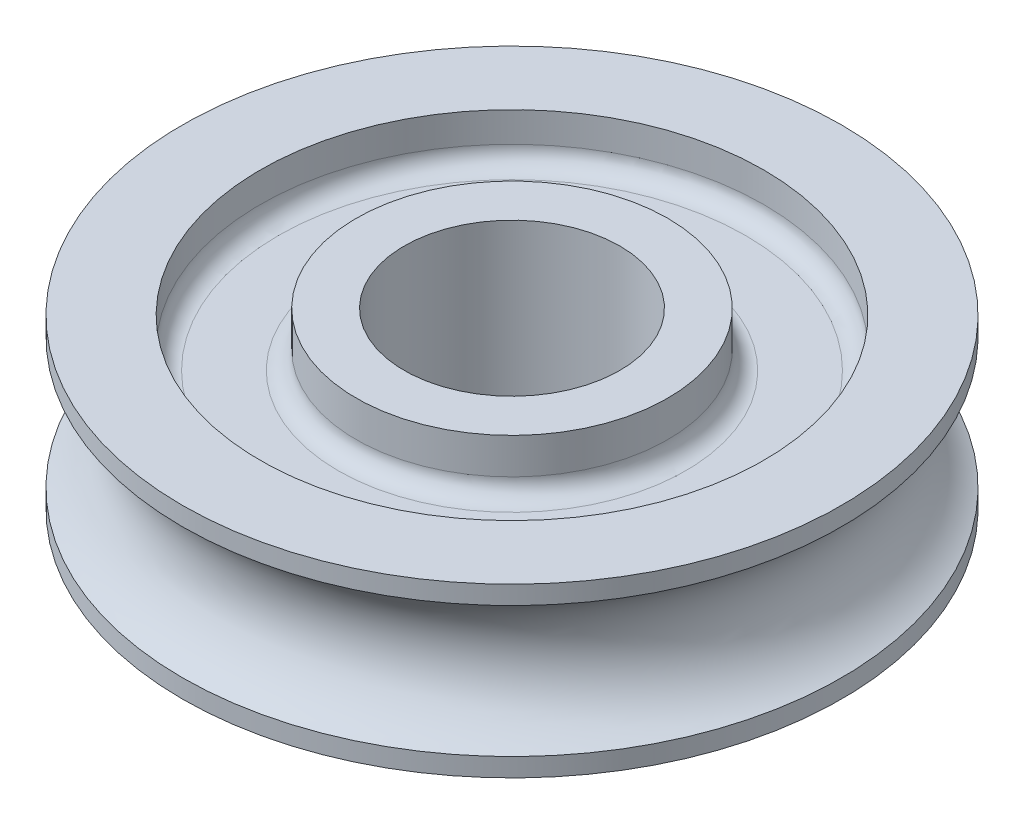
SolidWorks part; units mm, degrees
ref_plane "Plan de face" through (0, 0, 0) normal (0, 0, 1) x (1, 0, 0)
ref_plane "Plan de dessus" through (0, 0, 0) normal (0, 1, 0) x (1, 0, 0)
ref_plane "Plan de droite" through (0, 0, 0) normal (1, 0, 0) x (0, 0, -1)
ref_plane "Plan4" through (0, 0, 0) normal (0, 0, -1) x (-1, 0, 0)
sketch "Esquisse10" plane through (0, 0, 0) normal (0, 0, 1) x (1, 0, 0)
  line L0 (-18, -15) -> (-26, -15)
  line L1 (0, -31.9033) -> (0, 31.9033) construction
  line L3 (-26, -15) -> (-26, -9)
  line L6 (-29, -6) -> (-39, -6)
  line L9 (-42, -9) -> (-42, -14)
  line L11 (-42, -14) -> (-55, -14)
  line L13 (-55, -14) -> (-55, -10.9087)
  line L15 (-55, 14) -> (-55, 10.9087)
  line L18 (-42, 14) -> (-55, 14)
  line L20 (-42, 9) -> (-42, 14)
  line L23 (-29, 6) -> (-39, 6)
  line L26 (-26, 15) -> (-26, 9)
  line L28 (-18, 15) -> (-26, 15)
  line L30 (-18, 15) -> (-18, -15)
  line L31 (0, 0) -> (-58.7223, 0) construction
  arc A0 (-26, -9) -> (-29, -6) centre (-29, -9) ccw
  arc A1 (-39, -6) -> (-42, -9) centre (-39, -9) ccw
  arc A2 (-39, 6) -> (-42, 9) centre (-39, 9) cw
  arc A3 (-26, 9) -> (-29, 6) centre (-29, 9) cw
  arc A4 (-55, 10.9087) -> (-55, -10.9087) centre (-60, 0) cw
  point P36 (-18, 0)
  dimension "D2" = 8
  dimension "D3" = 3
  dimension "D6" = 3
  dimension "D7" = 12
  dimension "D1" = 60
  dimension "D4" = 42
  dimension "D5" = 14
  dimension "D8" = 18
  dimension "D9" = 30
  dimension "D10" = 55
  dimension "D11" = 6
revolve "Révolution2" add sketch "Esquisse10" angle 360 about L1
